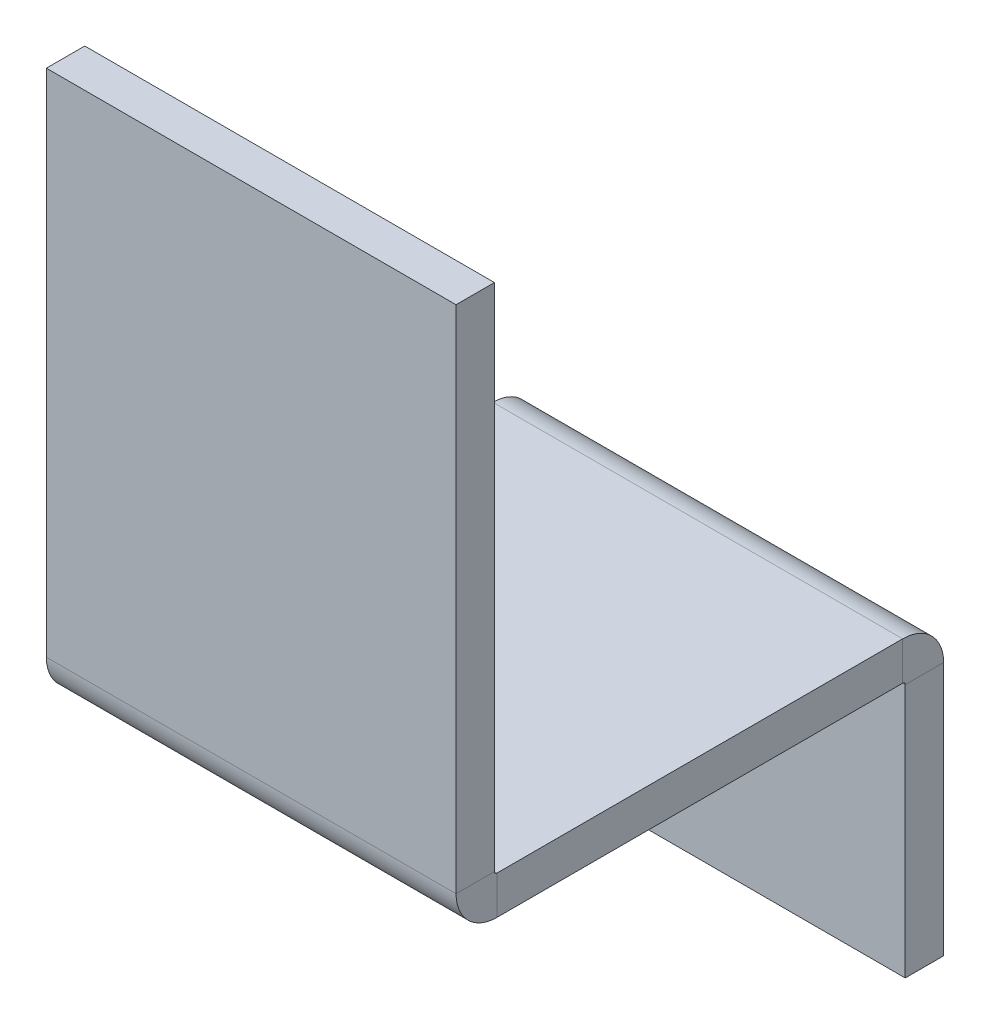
SolidWorks part; units mm, degrees
ref_plane "Front Plane" through (0, 0, 0) normal (0, 0, 1) x (1, 0, 0)
ref_plane "Top Plane" through (0, 0, 0) normal (0, 1, 0) x (1, 0, 0)
ref_plane "Right Plane" through (0, 0, 0) normal (1, 0, 0) x (0, 0, -1)
sketch "Sketch1" plane through (0, 0, 0) normal (0, 1, 0) x (1, 0, 0)
  line L0 (8, 46) -> (8, 0) construction
  line L1 (0, 0) -> (16, 0)
  line L2 (0, 0) -> (0, 46)
  line L3 (0, 46) -> (16, 46)
  line L4 (16, 0) -> (16, 46)
  circle A0 centre (8, 41) radius 1.75
  dimension "D3" = 3.5
  dimension "D4" = 5
  dimension "D1" = 16
  dimension "D2" = 46
sheet metal parameters "Sheet-Metal1" thickness 1.5 parameters "D1"=1
base flange "Base-Flange1" sketch "Sketch1" thickness 1.5 reverse thickness direction yes parameters "D1"=1
sketch "Sketch3" plane through (0, 1.5, 0) normal (0, 1, 0) x (1, 0, 0)
  line L0 (0, 20) -> (16, 20)
  line L1 (0, 46) -> (0, 0) construction
  line L2 (16, 0) -> (16, 46) construction
  line L3 (0, 0) -> (16, 0) construction
  dimension "D1" = 20
sketched bend "Sketched Bend1" parameters "D1"=0.1
bend "SketchBend1" bend radius 0.1 bend angle 90 parameters "D5"=1
sketch "Sketch4" plane through (0, 0, 0) normal (0, -1, 0) x (1, 0, 0)
  line L0 (0, -36) -> (16, -36)
  line L1 (0, -46) -> (0, -20.0786) construction
  line L2 (16, -20.0786) -> (16, -46) construction
  line L3 (16, -46) -> (0, -46) construction
  dimension "D1" = 10
sketched bend "Sketched Bend2" parameters "D1"=0.1
bend "SketchBend2" bend radius 0.1 bend angle 90 parameters "D5"=2
flat pattern "Flat-Pattern1"
sketch "Bend-Lines1" plane through (0, 0, 0) normal (0, 1, 0) x (-1, 0, 0)
bend of the flat pattern "Flatten-<SketchBend1>1"
bend of the flat pattern "Flatten-<SketchBend2>1"
